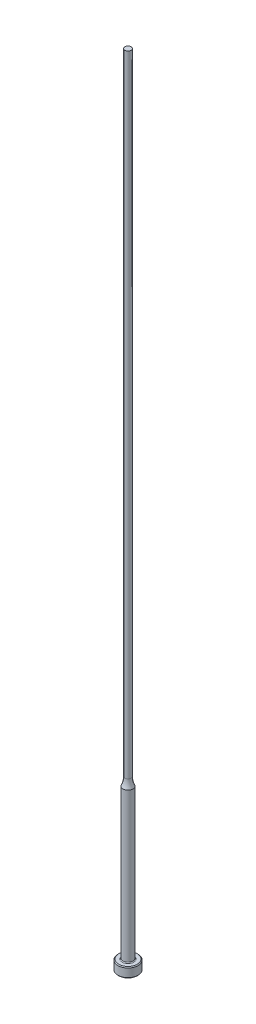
SolidWorks part; units mm, degrees
ref_plane "Front Plane" through (0, 0, 0) normal (0, 0, 1) x (1, 0, 0)
ref_plane "Top Plane" through (0, 0, 0) normal (0, 1, 0) x (1, 0, 0)
ref_plane "Right Plane" through (0, 0, 0) normal (1, 0, 0) x (0, 0, -1)
sketch "Sketch1" plane through (0, 0, 0) normal (0, 0, 1) x (1, 0, 0)
  line L0 (0, 259.9588) -> (0, -15.1925) construction
  line L1 (0, 0) -> (-3.175, 0)
  line L2 (-3.175, 0) -> (-3.175, 3.175)
  line L3 (-3.175, 3.175) -> (-1.5875, 3.175)
  line L4 (-0.9919, 53.4851) -> (-0.9919, 254)
  line L5 (-0.9919, 254) -> (0, 254)
  line L6 (0, 254) -> (0, 0)
  line L7 (-1.5875, 3.175) -> (-1.5875, 50.8)
  arc A0 (-1.5875, 50.8) -> (-0.9919, 53.4851) centre (-7.3419, 53.4851) ccw
  point P13 (-1.5875, 0)
  dimension "D1" = 6.35
  dimension "L" = 254
  dimension "D2" = 3.175
  dimension "H" = 6.35
  dimension "T" = 3.175
  dimension "D" = 1.9837
  dimension "S" = 50.8
revolve "Revolve1" add sketch "Sketch1" angle 360 about L0
chamfer "Chamfer1" distance 0.254 angle 45 2 edges at (0, 3.175, 3.175) (0, 0, 3.175)
fillet "Fillet1" radius 0.254 1 edges at (0, 3.175, 1.5875)
